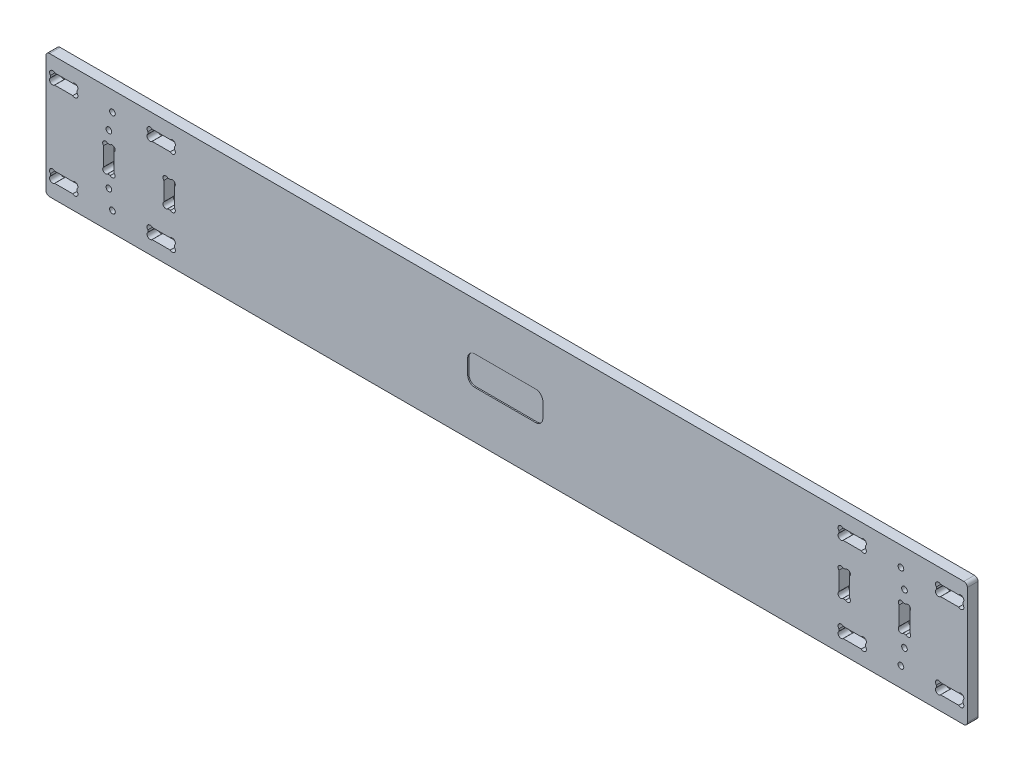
SolidWorks part; units mm, degrees
ref_plane "Plan de face" through (0, 0, 0) normal (0, 0, 1) x (1, 0, 0)
ref_plane "Plan de dessus" through (0, 0, 0) normal (0, 1, 0) x (1, 0, 0)
ref_plane "Plan de droite" through (0, 0, 0) normal (1, 0, 0) x (0, 0, -1)
sketch "Esquisse1" plane through (0, 0, 0) normal (0, 0, 1) x (1, 0, 0)
  line L0 (-15, -113.5938) -> (-15, -154.6345) construction
  line L1 (-11.2619, -129.5) -> (-12.7381, -129.5)
  line L2 (-15, -142.2381) -> (-15, -131.7619)
  line L3 (-11.2619, -144.5) -> (-12.7381, -144.5)
  line L4 (-9, -131.7619) -> (-9, -142.2381)
  line L5 (-396, -131.7619) -> (-396, -142.2381)
  line L6 (-393.7381, -144.5) -> (-392.2619, -144.5)
  line L7 (-390, -142.2381) -> (-390, -131.7619)
  line L8 (-393.7381, -129.5) -> (-392.2619, -129.5)
  line L9 (22, -129.5) -> (22, -116) construction
  line L39 (-202.5, -12.2716) -> (-202.5, -249.4423) construction
  line L40 (-245.487, -102) -> (122.7905, -102) construction
  line L41 (-241.5587, -137) -> (163.5466, -137) construction
  line L45 (-17.6557, -113) -> (3.5533, -113) construction
  line L46 (-12.5979, -110) -> (-2.4021, -110)
  line L47 (-15, -112.4062) -> (-15, -113.5938)
  line L48 (-12.5979, -116) -> (-2.4021, -116)
  line L49 (0, -112.4062) -> (0, -113.5938)
  line L50 (-7.5, -105.4379) -> (-7.5, -119.7735) construction
  line L51 (20, -103.6549) -> (20, -125.0558) construction
  line L52 (40, -112.4062) -> (40, -113.5938)
  line L53 (52.5979, -116) -> (42.4021, -116)
  line L54 (55, -112.4062) -> (55, -113.5938)
  line L55 (52.5979, -110) -> (42.4021, -110)
  line L56 (52.5979, -164) -> (42.4021, -164)
  line L57 (55, -161.5938) -> (55, -160.4062)
  line L58 (52.5979, -158) -> (42.4021, -158)
  line L59 (40, -161.5938) -> (40, -160.4062)
  line L60 (0, -161.5938) -> (0, -160.4062)
  line L61 (-12.5979, -158) -> (-2.4021, -158)
  line L62 (-15, -161.5938) -> (-15, -160.4062)
  line L63 (-12.5979, -164) -> (-2.4021, -164)
  line L64 (57.5, -89.0895) -> (57.5, -155.9194) construction
  line L65 (-460.5, -102) -> (55.5, -102)
  line L66 (57.5, -104) -> (57.5, -170)
  line L67 (-460.5, -172) -> (55.5, -172)
  line L68 (-462.5, -104) -> (-462.5, -170)
  line L69 (-445, -161.5938) -> (-445, -160.4062)
  line L70 (-457.5979, -158) -> (-447.4021, -158)
  line L71 (-460, -161.5938) -> (-460, -160.4062)
  line L72 (-457.5979, -164) -> (-447.4021, -164)
  line L73 (-392.4021, -164) -> (-402.5979, -164)
  line L74 (-390, -161.5938) -> (-390, -160.4062)
  line L75 (-392.4021, -158) -> (-402.5979, -158)
  line L76 (-405, -161.5938) -> (-405, -160.4062)
  line L77 (-405, -112.4062) -> (-405, -113.5938)
  line L78 (-392.4021, -116) -> (-402.5979, -116)
  line L79 (-390, -112.4062) -> (-390, -113.5938)
  line L80 (-392.4021, -110) -> (-402.5979, -110)
  line L81 (-457.5979, -110) -> (-447.4021, -110)
  line L82 (-460, -112.4062) -> (-460, -113.5938)
  line L83 (-457.5979, -116) -> (-447.4021, -116)
  line L84 (-445, -112.4062) -> (-445, -113.5938)
  line L85 (15.4269, -144.5) -> (29.7548, -144.5) construction
  line L86 (25, -131.7619) -> (25, -142.2381)
  line L87 (22.7381, -144.5) -> (21.2619, -144.5)
  line L88 (19, -142.2381) -> (19, -131.7619)
  line L89 (22.7381, -129.5) -> (21.2619, -129.5)
  line L90 (-430, -131.7619) -> (-430, -142.2381)
  line L91 (-424, -142.2381) -> (-424, -131.7619)
  line L92 (-427.7381, -144.5) -> (-426.2619, -144.5)
  line L93 (-427.7381, -129.5) -> (-426.2619, -129.5)
  arc A0 (55.5, -102) -> (57.5, -104) centre (55.5, -104) cw
  arc A1 (55.5, -172) -> (57.5, -170) centre (55.5, -170) ccw
  arc A2 (-462.5, -104) -> (-460.5, -102) centre (-460.5, -104) cw
  arc A3 (-462.5, -170) -> (-460.5, -172) centre (-460.5, -170) ccw
  arc A4 (-11.2619, -144.5) -> (-9, -142.2381) centre (-10.1, -143.4) ccw
  arc A5 (-15, -142.2381) -> (-12.7381, -144.5) centre (-13.9, -143.4) ccw
  arc A6 (-15, -131.7619) -> (-12.7381, -129.5) centre (-13.9, -130.6) cw
  arc A7 (-11.2619, -129.5) -> (-9, -131.7619) centre (-10.1, -130.6) cw
  arc A8 (-12.5979, -110) -> (-15, -112.4062) centre (-13.8, -111.2021) ccw
  arc A9 (-2.4021, -110) -> (0, -112.4062) centre (-1.2, -111.2021) cw
  arc A10 (-2.4021, -116) -> (0, -113.5938) centre (-1.2, -114.7979) ccw
  arc A11 (-12.5979, -116) -> (-15, -113.5938) centre (-13.8, -114.7979) cw
  arc A12 (52.5979, -116) -> (55, -113.5938) centre (53.8, -114.7979) ccw
  arc A13 (42.4021, -116) -> (40, -113.5938) centre (41.2, -114.7979) cw
  arc A14 (42.4021, -110) -> (40, -112.4062) centre (41.2, -111.2021) ccw
  arc A15 (52.5979, -110) -> (55, -112.4062) centre (53.8, -111.2021) cw
  arc A16 (52.5979, -164) -> (55, -161.5938) centre (53.8, -162.7979) ccw
  arc A17 (42.4021, -164) -> (40, -161.5938) centre (41.2, -162.7979) cw
  arc A18 (42.4021, -158) -> (40, -160.4062) centre (41.2, -159.2021) ccw
  arc A19 (52.5979, -158) -> (55, -160.4062) centre (53.8, -159.2021) cw
  arc A20 (-12.5979, -158) -> (-15, -160.4062) centre (-13.8, -159.2021) ccw
  arc A21 (-2.4021, -158) -> (0, -160.4062) centre (-1.2, -159.2021) cw
  arc A22 (-2.4021, -164) -> (0, -161.5938) centre (-1.2, -162.7979) ccw
  arc A23 (-12.5979, -164) -> (-15, -161.5938) centre (-13.8, -162.7979) cw
  circle A24 centre (20, -113) radius 1.6
  circle A25 centre (22, -122.75) radius 1.6
  circle A26 centre (22, -151.25) radius 1.6
  circle A27 centre (20, -161) radius 1.6
  circle A28 centre (-425, -161) radius 1.6
  circle A29 centre (-427, -151.25) radius 1.6
  circle A30 centre (-427, -122.75) radius 1.6
  circle A31 centre (-425, -113) radius 1.6
  arc A32 (-457.5979, -158) -> (-460, -160.4062) centre (-458.8, -159.2021) ccw
  arc A33 (-447.4021, -158) -> (-445, -160.4062) centre (-446.2, -159.2021) cw
  arc A34 (-447.4021, -164) -> (-445, -161.5938) centre (-446.2, -162.7979) ccw
  arc A35 (-457.5979, -164) -> (-460, -161.5938) centre (-458.8, -162.7979) cw
  arc A36 (-392.4021, -164) -> (-390, -161.5938) centre (-391.2, -162.7979) ccw
  arc A37 (-402.5979, -164) -> (-405, -161.5938) centre (-403.8, -162.7979) cw
  arc A38 (-402.5979, -158) -> (-405, -160.4062) centre (-403.8, -159.2021) ccw
  arc A39 (-392.4021, -158) -> (-390, -160.4062) centre (-391.2, -159.2021) cw
  arc A40 (-392.4021, -116) -> (-390, -113.5938) centre (-391.2, -114.7979) ccw
  arc A41 (-402.5979, -116) -> (-405, -113.5938) centre (-403.8, -114.7979) cw
  arc A42 (-402.5979, -110) -> (-405, -112.4062) centre (-403.8, -111.2021) ccw
  arc A43 (-392.4021, -110) -> (-390, -112.4062) centre (-391.2, -111.2021) cw
  arc A44 (-457.5979, -110) -> (-460, -112.4062) centre (-458.8, -111.2021) ccw
  arc A45 (-447.4021, -110) -> (-445, -112.4062) centre (-446.2, -111.2021) cw
  arc A46 (-447.4021, -116) -> (-445, -113.5938) centre (-446.2, -114.7979) ccw
  arc A47 (-457.5979, -116) -> (-460, -113.5938) centre (-458.8, -114.7979) cw
  arc A48 (19, -142.2381) -> (21.2619, -144.5) centre (20.1, -143.4) ccw
  arc A49 (22.7381, -144.5) -> (25, -142.2381) centre (23.9, -143.4) ccw
  arc A50 (19, -131.7619) -> (21.2619, -129.5) centre (20.1, -130.6) cw
  arc A51 (22.7381, -129.5) -> (25, -131.7619) centre (23.9, -130.6) cw
  arc A52 (-424, -142.2381) -> (-426.2619, -144.5) centre (-425.1, -143.4) cw
  arc A53 (-427.7381, -144.5) -> (-430, -142.2381) centre (-428.9, -143.4) cw
  arc A54 (-424, -131.7619) -> (-426.2619, -129.5) centre (-425.1, -130.6) ccw
  arc A55 (-427.7381, -129.5) -> (-430, -131.7619) centre (-428.9, -130.6) ccw
  arc A56 (-393.7381, -129.5) -> (-396, -131.7619) centre (-394.9, -130.6) ccw
  arc A57 (-390, -131.7619) -> (-392.2619, -129.5) centre (-391.1, -130.6) ccw
  arc A58 (-390, -142.2381) -> (-392.2619, -144.5) centre (-391.1, -143.4) cw
  arc A59 (-393.7381, -144.5) -> (-396, -142.2381) centre (-394.9, -143.4) cw
  point P2 (57.5, -102)
  point P6 (57.5, -172)
  point P10 (-462.5, -102)
  point P14 (-462.5, -172)
  point P158 (57.5, -137)
  point P160 (-202.5, -102)
  point P161 (-202.5, -172)
  point P219 (19, -137)
  point P233 (25, -137)
  dimension "D5" = 260
  dimension "D10" = 1.7
  dimension "D12" = 1.7
  dimension "D14" = 1.1
  dimension "D15" = 1.7
  dimension "D16" = 1.1
  dimension "D9" = 7.5
  dimension "D11" = 1.1
  dimension "D4" = 3.2
  dimension "D6" = 1.2021
  dimension "D8" = 1.7
  dimension "D25" = 2
  dimension "D2" = 6
  dimension "D3" = 15
  dimension "D7" = 1.2
  dimension "D13" = 1.1
  dimension "D17" = 1.2021
  dimension "D18" = 1.2
  dimension "D19" = 1.2
  dimension "D20" = 1.2021
  dimension "D21" = 1.2
  dimension "D22" = 1.2021
  dimension "D23" = 35
  dimension "D24" = 21
  dimension "D26" = 24
extrude "Extrusion1" add sketch "Esquisse1" along normal blind 6
sketch "Esquisse2" plane through (0, 0, 6) normal (0, 0, 1) x (1, 0, 0)
  line L0 (-462.5, -104) -> (-462.5, -170) construction
  line L1 (-220.5, -128.8) -> (-186.1, -128.8)
  line L2 (-224.5, -132.8) -> (-224.5, -141.2)
  line L3 (-220.5, -145.2) -> (-186.1, -145.2)
  line L4 (-182.1, -132.8) -> (-182.1, -141.2)
  line L5 (-460.5, -172) -> (55.5, -172) construction
  arc A0 (-186.1, -128.8) -> (-182.1, -132.8) centre (-186.1, -132.8) cw
  arc A1 (-220.5, -128.8) -> (-224.5, -132.8) centre (-220.5, -132.8) ccw
  arc A2 (-224.5, -141.2) -> (-220.5, -145.2) centre (-220.5, -141.2) ccw
  arc A3 (-186.1, -145.2) -> (-182.1, -141.2) centre (-186.1, -141.2) ccw
  dimension "D3" = 4
  dimension "D1" = 16.4
  dimension "D2" = 42.4
  dimension "D4" = 238
  dimension "D5" = 26.8
extrude "Enlèv. mat.-Extru.1" cut sketch "Esquisse2" against normal blind 0.7
